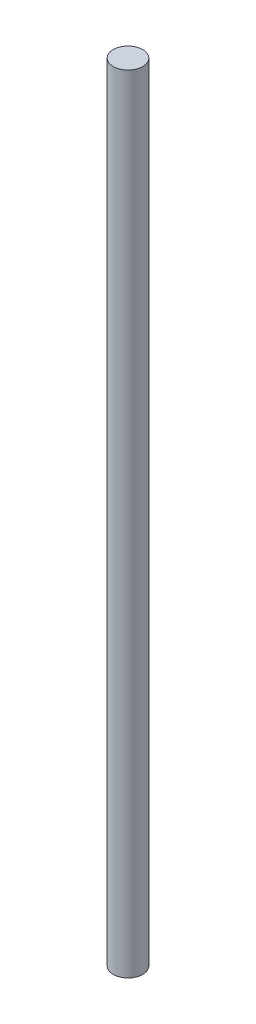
SolidWorks part; units mm, degrees
ref_plane "Front Plane" through (0, 0, 0) normal (0, 0, 1) x (1, 0, 0)
ref_plane "Top Plane" through (0, 0, 0) normal (0, 1, 0) x (1, 0, 0)
ref_plane "Right Plane" through (0, 0, 0) normal (1, 0, 0) x (0, 0, -1)
sketch "Sketch1" plane through (0, 0, 0) normal (0, 1, 0) x (1, 0, 0)
  circle A0 centre (0, 0) radius 4.7625
  dimension "D1" = 9.525
extrude "Extrude1" add sketch "Sketch1" along normal mid plane 254
